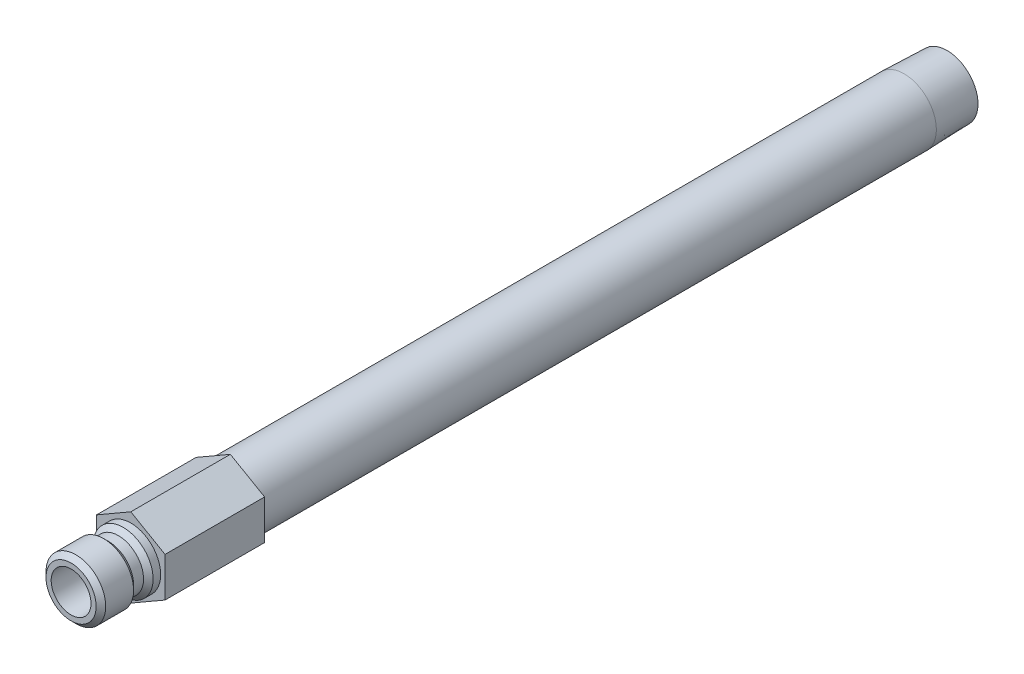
SolidWorks part; units mm, degrees
ref_plane "Front Plane" through (0, 0, 0) normal (0, 0, 1) x (1, 0, 0)
ref_plane "Top Plane" through (0, 0, 0) normal (0, 1, 0) x (1, 0, 0)
ref_plane "Right Plane" through (0, 0, 0) normal (1, 0, 0) x (0, 0, -1)
sketch "Sketch1" plane through (0, 0, 0) normal (1, 0, 0) x (0, 0, -1)
  line L0 (0, 0) -> (-12.7, 0) construction
  line L1 (-9.525, 3.175) -> (-9.525, 4.0005)
  line L2 (-3.556, 4.0005) -> (-3.556, 0) construction
  line L3 (-8.763, 4.7625) -> (-4.318, 4.7625)
  line L4 (0, 5.1435) -> (0, 3.4163) construction
  line L5 (-3.556, 4.0005) -> (-1.9685, 4.0005)
  line L6 (-1.2065, 4.7625) -> (0, 4.7625)
  line L7 (0, 4.7625) -> (0, 5.1435)
  line L8 (-3.556, 4.0005) -> (-4.318, 4.7625)
  line L9 (-1.9685, 4.0005) -> (-1.2065, 4.7625)
  line L10 (-9.525, 4.0005) -> (-8.763, 4.7625)
  line L12 (0, 5.1435) -> (123.317, 5.1435)
  line L13 (123.317, 5.1435) -> (130.175, 4.9292)
  line L14 (130.175, 4.9292) -> (130.175, 2.3813)
  line L15 (0, 0) -> (15.875, 0) construction
  line L16 (15.875, 0) -> (15.875, 4.7625) construction
  line L17 (15.875, 4.7625) -> (0, 4.7625) construction
  line L18 (0.127, 2.3813) -> (130.175, 2.3813)
  line L19 (0.127, 3.175) -> (-9.525, 3.175)
  line L20 (0, 3.175) -> (0, 0) construction
  line L21 (0.127, 2.3813) -> (0.127, 3.175)
  dimension "D1" = 9.525
  dimension "D2" = 1.5875
  dimension "D3" = 0.762
  dimension "D4" = 45
  dimension "D5" = 5.969
  dimension "D6" = 45
  dimension "D7" = 1.79
  dimension "D8" = 6.858
  dimension "D9" = 139.7
  dimension "D10" = 3.175
  dimension "D11" = 25.4
  dimension "D12" = 4.7625
  dimension "D13" = 6.35
  dimension "D14" = 9.525
  dimension "D15" = 10.287
  dimension "D16" = 9.652
revolve "Revolve1" add sketch "Sketch1" angle 360 about L0
sketch "Sketch2" plane through (0, 0, 0) normal (0, 0, 1) x (1, 0, 0)
  line L1 (-5.461, 3.1529) -> (-5.461, -3.1529)
  line L2 (-5.461, -3.1529) -> (0, -6.3058)
  line L3 (0, -6.3058) -> (5.461, -3.1529)
  line L4 (5.461, -3.1529) -> (5.461, 3.1529)
  line L5 (5.461, 3.1529) -> (0, 6.3058)
  line L6 (0, 6.3058) -> (-5.461, 3.1529)
  circle A0 centre (0, 0) radius 5.461 construction
  circle A1 centre (0, 0) radius 2.3812 construction
  circle A2 centre (0, 0) radius 2.3812
  dimension "D1" = 10.922
extrude "Boss-Extrude1" add sketch "Sketch2" against normal up to vertex (15.875 mm away) from vertex at 0
